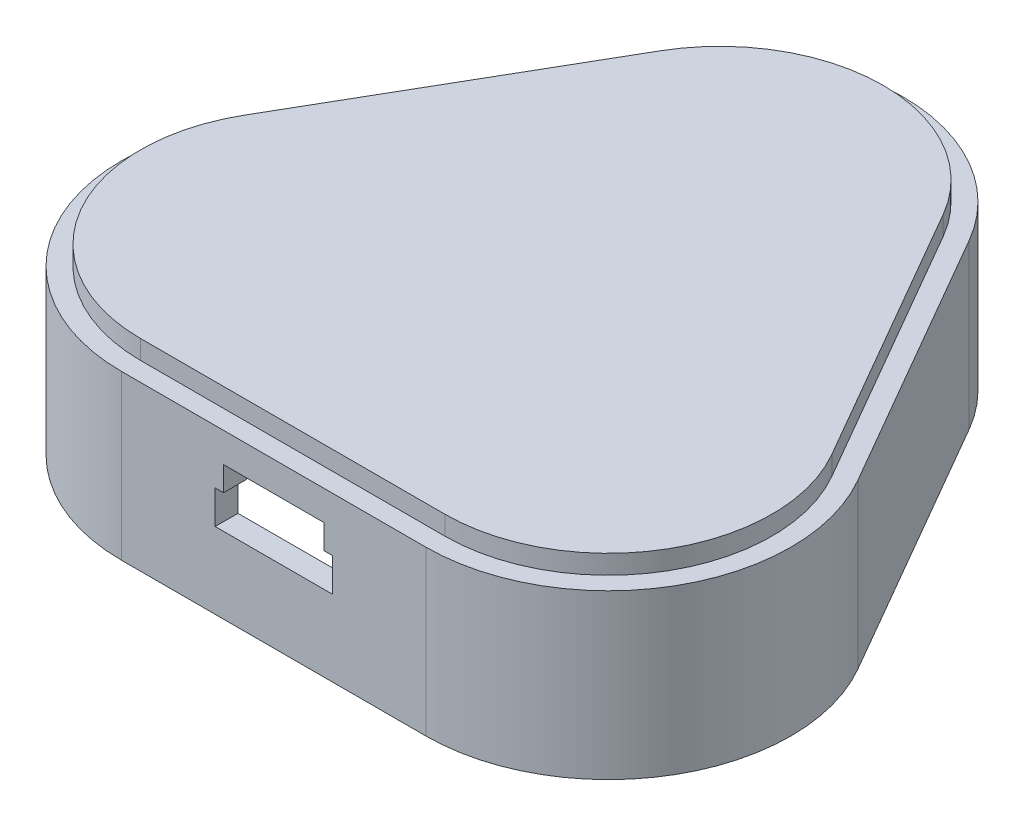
SolidWorks part; units mm, degrees
ref_plane "Спереди" through (0, 0, 0) normal (0, 0, 1) x (1, 0, 0)
ref_plane "Сверху" through (0, 0, 0) normal (0, 1, 0) x (1, 0, 0)
ref_plane "Справа" through (0, 0, 0) normal (1, 0, 0) x (0, 0, -1)
sketch "Эскиз1" plane through (0, 0, 0) normal (0, 1, 0) x (1, 0, 0)
  line L0 (0, 0) -> (0, 11.547) construction
  line L1 (0, 0) -> (10, -5.7735) construction
  line L2 (0, 0) -> (-10, -5.7735) construction
  line L3 (10.3923, 17.547) -> (20.3923, 0.2265)
  line L4 (10, -17.7735) -> (-10, -17.7735)
  line L5 (-10.3923, 17.547) -> (-20.3923, 0.2265)
  arc A0 (-10.3923, 17.547) -> (10.3923, 17.547) centre (0, 11.547) cw
  arc A1 (20.3923, 0.2265) -> (10, -17.7735) centre (10, -5.7735) cw
  arc A2 (-20.3923, 0.2265) -> (-10, -17.7735) centre (-10, -5.7735) ccw
  dimension "D1" = 12
  dimension "D5" = 41.3205
  dimension "D6" = 44
  dimension "D2" = 120
  dimension "D3" = 120
  dimension "D4" = 20
extrude "Бобышка-Вытянуть1" add sketch "Эскиз1" along normal blind 12
sketch "Эскиз2" plane through (0, 0, 0) normal (0, -1, 0) x (1, 0, 0)
  line L0 (-10, 15.2735) -> (10, 15.2735)
  line L1 (18.2272, 1.0235) -> (8.2272, -16.297)
  line L2 (18.2272, 10.5235) -> (-15.3923, -8.8868) construction
  line L4 (-8.2272, -16.297) -> (-18.2272, 1.0235)
  line L6 (-10.3923, -17.547) -> (-20.3923, -0.2265) construction
  arc A0 (18.2272, 1.0235) -> (10, 15.2735) centre (10, 5.7735) ccw
  arc A1 (-10, 15.2735) -> (-18.2272, 1.0235) centre (-10, 5.7735) ccw
  arc A2 (-8.2272, -16.297) -> (8.2272, -16.297) centre (0, -11.547) ccw
  arc A3 (20.3923, -0.2265) -> (10, 17.7735) centre (10, 5.7735) ccw construction
  arc A4 (-10, 17.7735) -> (-20.3923, -0.2265) centre (-10, 5.7735) ccw construction
  arc A5 (-10.3923, -17.547) -> (10.3923, -17.547) centre (0, -11.547) ccw construction
  dimension "D1" = 19
extrude "Вырез-Вытянуть1" cut sketch "Эскиз2" against normal offset from surface (10.5 mm away) 1.5
sketch "Эскиз3" plane through (0, 0, 0) normal (0, -1, 0) x (1, 0, 0)
  line L12 (9.3098, -16.922) -> (19.3098, 0.3985)
  line L13 (10, 16.5235) -> (-10, 16.5235)
  line L14 (-19.3098, 0.3985) -> (-9.3098, -16.922)
  line L15 (9.3098, -16.922) -> (19.3098, 0.3985)
  line L16 (10, 16.5235) -> (-10, 16.5235)
  line L17 (-19.3098, 0.3985) -> (-9.3098, -16.922)
  arc A15 (19.3098, 0.3985) -> (10, 16.5235) centre (10, 5.7735) ccw
  arc A16 (-10, 16.5235) -> (-19.3098, 0.3985) centre (-10, 5.7735) ccw
  arc A17 (-9.3098, -16.922) -> (9.3098, -16.922) centre (0, -11.547) ccw
  arc A18 (19.3098, 0.3985) -> (10, 16.5235) centre (10, 5.7735) ccw
  arc A19 (-10, 16.5235) -> (-19.3098, 0.3985) centre (-10, 5.7735) ccw
  arc A20 (-9.3098, -16.922) -> (9.3098, -16.922) centre (0, -11.547) ccw
  dimension "D1" = 1.25
extrude "Вырез-Вытянуть2" cut sketch "Эскиз3" against normal blind 1.25
sketch "Эскиз4" plane through (0, 12, 0) normal (0, 1, 0) x (1, 0, 0)
  line L6 (-9.3098, 16.922) -> (-19.3098, -0.3985)
  line L7 (-10, -16.5235) -> (10, -16.5235)
  line L8 (19.3098, -0.3985) -> (9.3098, 16.922)
  line L9 (-9.3098, 16.922) -> (-19.3098, -0.3985)
  line L10 (-10, -16.5235) -> (10, -16.5235)
  line L11 (19.3098, -0.3985) -> (9.3098, 16.922)
  line L12 (-10.3923, 17.547) -> (-20.3923, 0.2265)
  line L13 (-10, -17.7735) -> (10, -17.7735)
  line L14 (20.3923, 0.2265) -> (10.3923, 17.547)
  line L15 (-10.3923, 17.547) -> (-20.3923, 0.2265)
  line L16 (-10, -17.7735) -> (10, -17.7735)
  line L17 (20.3923, 0.2265) -> (10.3923, 17.547)
  arc A6 (9.3098, 16.922) -> (-9.3098, 16.922) centre (0, 11.547) ccw
  arc A7 (-19.3098, -0.3985) -> (-10, -16.5235) centre (-10, -5.7735) ccw
  arc A8 (10, -16.5235) -> (19.3098, -0.3985) centre (10, -5.7735) ccw
  arc A9 (9.3098, 16.922) -> (-9.3098, 16.922) centre (0, 11.547) ccw
  arc A10 (-19.3098, -0.3985) -> (-10, -16.5235) centre (-10, -5.7735) ccw
  arc A11 (10, -16.5235) -> (19.3098, -0.3985) centre (10, -5.7735) ccw
  arc A12 (10.3923, 17.547) -> (-10.3923, 17.547) centre (0, 11.547) ccw
  arc A13 (-20.3923, 0.2265) -> (-10, -17.7735) centre (-10, -5.7735) ccw
  arc A14 (10, -17.7735) -> (20.3923, 0.2265) centre (10, -5.7735) ccw
  arc A15 (10.3923, 17.547) -> (-10.3923, 17.547) centre (0, 11.547) ccw
  arc A16 (-20.3923, 0.2265) -> (-10, -17.7735) centre (-10, -5.7735) ccw
  arc A17 (10, -17.7735) -> (20.3923, 0.2265) centre (10, -5.7735) ccw
  dimension "D1" = 1.25
  dimension "D2" = 0
extrude "Вырез-Вытянуть4" cut sketch "Эскиз4" against normal blind 1.25
sketch "Эскиз5" plane through (0, 0, 15.2735) normal (0, 0, -1) x (-1, 0, 0)
  line L0 (0, 10.5) -> (0, 0.7108) construction
  line L1 (10, 10.5) -> (-10, 10.5) construction
  line L2 (-3.3, 8.8) -> (3.3, 8.8)
  line L3 (3.3, 8.8) -> (3.3, 7.2)
  line L4 (3.3, 7.2) -> (3.85, 7.2)
  line L5 (3.85, 7.2) -> (3.85, 5)
  line L6 (3.85, 5) -> (-3.85, 5)
  line L7 (-3.85, 7.2) -> (-3.85, 5)
  line L8 (-3.3, 7.2) -> (-3.85, 7.2)
  line L9 (-3.3, 8.8) -> (-3.3, 7.2)
  point P12 (0, 5)
  point P15 (0, 8.8)
  dimension "D1" = 1.7
  dimension "D2" = 3.8
  dimension "D3" = 7.7
  dimension "D4" = 6.6
  dimension "D5" = 2.2
extrude "Вырез-Вытянуть5" cut sketch "Эскиз5" against normal up to next
sketch "Эскиз8" plane through (0, 0, 15.2735) normal (0, 0, -1) x (-1, 0, 0)
  line L0 (0, 10.5) -> (0, 11.4844) construction
  line L1 (10, 10.5) -> (-10, 10.5) construction
  line L3 (9, 10.5) -> (-9, 10.5)
  line L4 (9, 10.5) -> (9, 2.5)
  line L5 (9, 2.5) -> (-9, 2.5)
  line L6 (-9, 10.5) -> (-9, 2.5)
  dimension "D1" = 8
  dimension "D2" = 18
extrude "Вырез-Вытянуть7" cut sketch "Эскиз8" against normal blind 1
sketch "Эскиз9" plane through (0, 10.5, 0) normal (0, -1, 0) x (-1, 0, 0)
  line L0 (0, -16.2735) -> (0, 0) construction
  line L1 (9, -16.2735) -> (-9, -16.2735) construction
  line L2 (8.2272, 16.297) -> (18.2272, -1.0235) construction
  line L3 (13.926, 6.4265) -> (-13.926, 6.4265)
  line L4 (-18.2272, -1.0235) -> (-8.2272, 16.297) construction
  line L5 (12.7713, 8.4265) -> (-12.7713, 8.4265)
  line L6 (12.7713, 8.4265) -> (13.926, 6.4265)
  line L7 (-12.7713, 8.4265) -> (-13.926, 6.4265)
  dimension "D1" = 22.7
  dimension "D2" = 2
extrude "Бобышка-Вытянуть2" add sketch "Эскиз9" along normal blind 3
